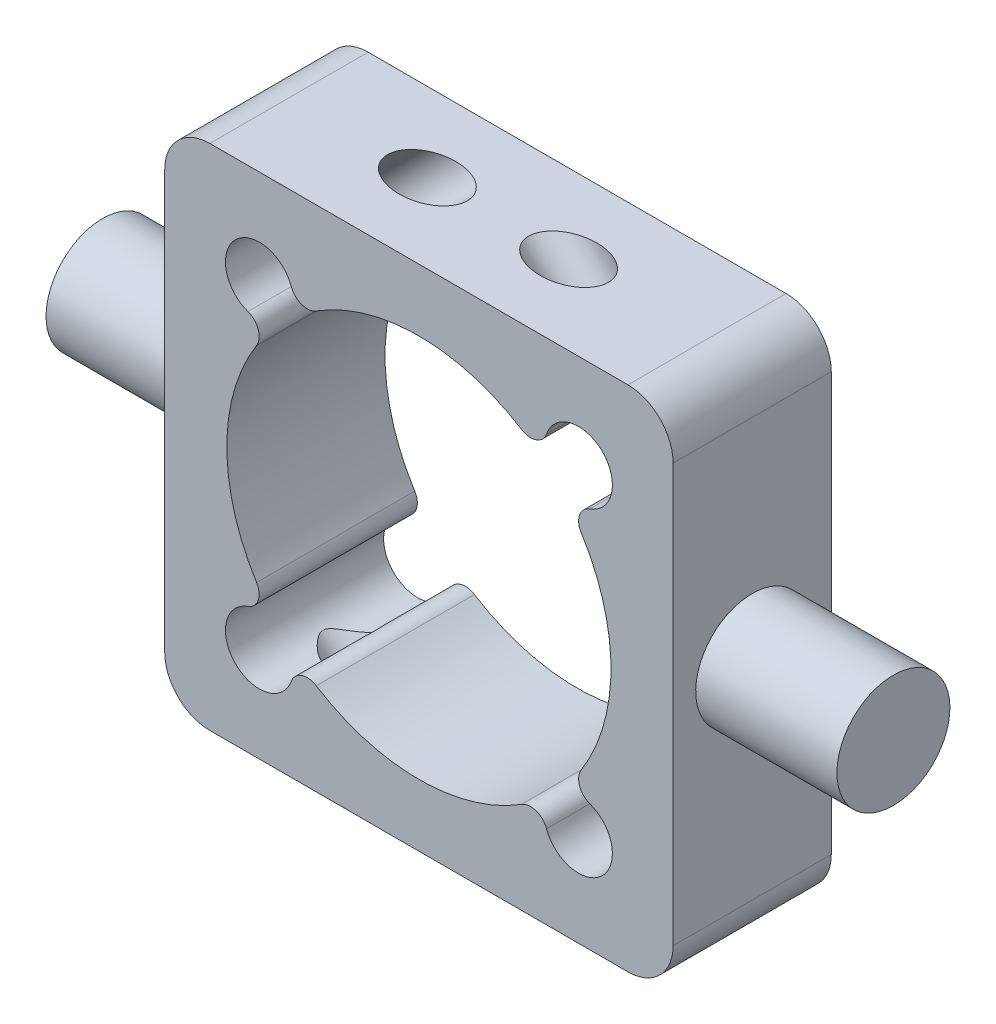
SolidWorks part; units mm, degrees
ref_plane "Plano frontal" through (0, 0, 0) normal (0, 0, 1) x (1, 0, 0)
ref_plane "Plano superior" through (0, 0, 0) normal (0, 1, 0) x (1, 0, 0)
ref_plane "Plano direito" through (0, 0, 0) normal (1, 0, 0) x (0, 0, -1)
sketch "Esboço1" plane through (0, 0, 0) normal (0, 0, 1) x (1, 0, 0)
  line L0 (0, 24.4094) -> (0, -31.769) construction
  line L1 (-45, 45) -> (45, 45)
  line L2 (-45, 45) -> (-45, -45)
  line L3 (-45, -45) -> (45, -45)
  line L4 (45, 45) -> (45, -45)
  line L5 (-35.6169, 0) -> (36.185, 0) construction
  arc A0 (-28.7377, 18.1698) -> (-28.7377, -18.1698) centre (0, 0) ccw
  arc A1 (-22.5987, 30.2656) -> (-30.2656, 22.5987) centre (-28.25, 28.25) ccw
  arc A2 (30.2656, 22.5987) -> (22.5987, 30.2656) centre (28.25, 28.25) ccw
  arc A3 (22.5987, -30.2656) -> (30.2656, -22.5987) centre (28.25, -28.25) ccw
  arc A4 (-30.2656, -22.5987) -> (-22.5987, -30.2656) centre (-28.25, -28.25) ccw
  arc A5 (18.1698, 28.7377) -> (-18.1698, 28.7377) centre (0, 0) ccw
  arc A6 (28.7377, -18.1698) -> (28.7377, 18.1698) centre (0, 0) ccw
  arc A7 (-18.1698, -28.7377) -> (18.1698, -28.7377) centre (0, 0) ccw
  arc A8 (-22.5987, 30.2656) -> (-18.1698, 28.7377) centre (-19.773, 31.2734) ccw
  arc A9 (-28.7377, 18.1698) -> (-30.2656, 22.5987) centre (-31.2734, 19.773) ccw
  arc A10 (-18.1698, -28.7377) -> (-22.5987, -30.2656) centre (-19.773, -31.2734) ccw
  arc A11 (-30.2656, -22.5987) -> (-28.7377, -18.1698) centre (-31.2734, -19.773) ccw
  arc A12 (18.1698, -28.7377) -> (22.5987, -30.2656) centre (19.773, -31.2734) cw
  arc A13 (28.7377, -18.1698) -> (30.2656, -22.5987) centre (31.2734, -19.773) ccw
  arc A14 (28.7377, 18.1698) -> (30.2656, 22.5987) centre (31.2734, 19.773) cw
  arc A15 (18.1698, 28.7377) -> (22.5987, 30.2656) centre (19.773, 31.2734) ccw
  point P28 (-23.5401, -24.5329)
  point P35 (24.5329, -23.5401)
  point P40 (23.5401, 24.5329)
  dimension "D2" = 68
  dimension "D4" = 12
  dimension "D6" = 3
  dimension "D1" = 90
  dimension "D3" = 56.5
  dimension "D5" = 56.5
extrude "Extrusão1" add sketch "Esboço1" along normal blind 28
sketch "Esboço2" plane through (-45, 0, 0) normal (-1, 0, 0) x (0, 0, 1)
  line L0 (14, 45) -> (14, -45) construction
  line L1 (28, 45) -> (0, 45) construction
  line L2 (28, -45) -> (0, -45) construction
  line L3 (0, 0) -> (28, 0) construction
  line L4 (0, 45) -> (0, -45) construction
  line L5 (28, 45) -> (28, -45) construction
  circle A0 centre (14, 0) radius 10
  dimension "D1" = 20
extrude "Extrusão2" add sketch "Esboço2" along normal blind 25
mirror "Espelhar1" about plane through (0, 0, 0) normal (1, 0, 0) of "Extrusão2"
fillet "Filete2" radius 8 4 edges at (-45, 45, 14) (45, 45, 14) (45, -45, 14) (-45, -45, 14)
ref_plane "Plano1" through (0, 0, 0) normal (1, 0, 0) x (0, 0, -1)
ref_plane "Plano2" through (3.8335, -3.8335, 0) normal (0.7071, -0.7071, 0) x (0.7071, 0.7071, 0)
ref_plane "Plano3" through (-20.2082, 20.2082, 0) normal (0.7071, -0.7071, 0) x (0.7071, 0.7071, 0)
sketch "Esboço6" plane through (-20.2082, 20.2082, 0) normal (0.7071, -0.7071, 0) x (0.7071, 0.7071, 0)
  line L0 (31.9952, 14) -> (-1.9393, 14) construction
  line L1 (57.9828, 0) -> (5.6569, 0) construction
  line L2 (57.9828, 28) -> (5.6569, 28) construction
  line L3 (5.6569, 0) -> (5.6569, 28) construction
  circle A0 centre (40.6569, 14) radius 5
  dimension "D1" = 10
  dimension "D2" = 35
extrude "Extrusão5" cut sketch "Esboço6" along normal blind 30
mirror "Espelhar2" about plane through (0, 0, 0) normal (1, 0, 0) of "Extrusão5"
mirror "Espelhar3" about plane through (0, 0, 0) normal (0, 1, 0) of "Espelhar2", "Extrusão5"
